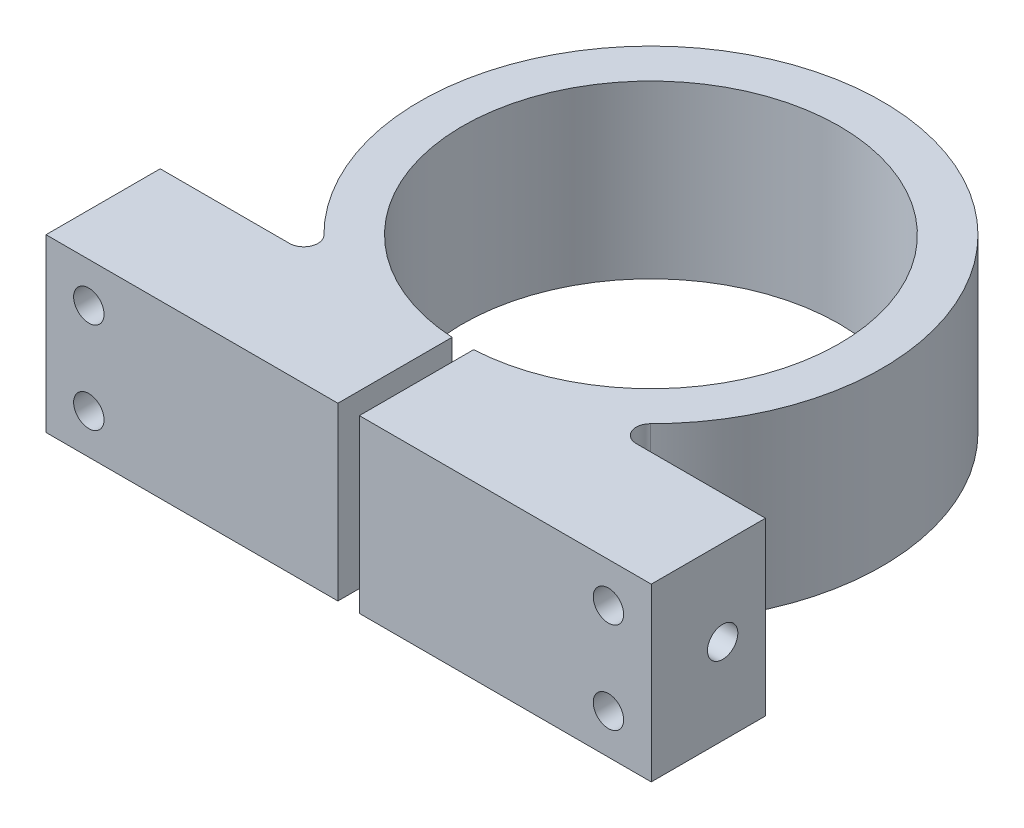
SolidWorks part; units mm, degrees
ref_plane "Front Plane" through (0, 0, 0) normal (0, 0, 1) x (1, 0, 0)
ref_plane "Top Plane" through (0, 0, 0) normal (0, 1, 0) x (1, 0, 0)
ref_plane "Right Plane" through (0, 0, 0) normal (1, 0, 0) x (0, 0, -1)
sketch "Sketch1" plane through (0, 0, 0) normal (0, 1, 0) x (1, 0, 0)
  line L0 (2.3876, -67.2419) -> (67.31, -67.2419)
  line L1 (-67.31, -41.8419) -> (-38.5632, -41.8419)
  line L2 (-67.31, -41.8419) -> (-67.31, -67.2419)
  line L3 (-67.31, -67.2419) -> (-2.3876, -67.2419)
  line L4 (67.31, -41.8419) -> (67.31, -67.2419)
  line L5 (38.5632, -41.8419) -> (67.31, -41.8419)
  line L6 (-51.435, 0) -> (51.435, 0) construction
  line L8 (-2.3876, -67.2419) -> (-2.3876, -41.8419)
  line L10 (2.3876, -67.2419) -> (2.3876, -41.8419)
  arc A0 (2.3876, -41.8419) -> (-2.3876, -41.8419) centre (0, 0) ccw
  arc A1 (36.3212, -36.4189) -> (-36.3212, -36.4189) centre (0, 0) ccw
  arc A2 (-38.5632, -41.8419) -> (-36.3212, -36.4189) centre (-38.5632, -38.6669) ccw
  arc A3 (36.3212, -36.4189) -> (38.5632, -41.8419) centre (38.5632, -38.6669) ccw
  dimension "D3" = 9.525
  dimension "D4" = 41.91
  dimension "D8" = 3.175
  dimension "D1" = 15.875
  dimension "D5" = 25.4
  dimension "D6" = 4.7752
  dimension "D7" = 2.3876
  dimension "D9" = 15.875
extrude "Extrude1" add sketch "Sketch1" along normal blind 38.1
hole_wizard "1/4 Clearance Hole2" positions "3DSketch1" profile "Sketch2" hole size "1/4" standard "Ansi Inch"
sketch3d "3DSketch1"
  line L0 (-67.31, 0, 41.8419) -> (-67.31, 0, 67.2419) construction
  line L2 (-67.31, 38.1, 67.2419) -> (-67.31, 0, 67.2419) construction
  point P0 (-67.31, 19.05, 51.3669)
  dimension "D1" = 19.05
  dimension "D2" = 15.875
sketch "Sketch2" plane through (-67.31, 19.05, 51.3669) normal (0, 1, 0) x (0, 0, 1)
  line L0 (0, 0) -> (0, 134.62)
  line L1 (0, 134.62) -> (3.3782, 134.62)
  line L2 (3.3782, 134.62) -> (3.3782, 0)
  line L5 (3.3782, 0) -> (0, 0)
  line L11 (0, -6.35) -> (0, 107.95) construction
  dimension "Thru Hole Dia." = 6.7564
  dimension "Thru Hole Depth" = 134.62
hole_wizard "1/4 Clearance Hole1" positions "3DSketch2" profile "Sketch3" hole size "1/4" standard "Ansi Inch"
sketch3d "3DSketch2"
  line L0 (-67.31, 38.1, 41.8419) -> (-67.31, 0, 41.8419) construction
  line L1 (-38.5632, 38.1, 41.8419) -> (-67.31, 38.1, 41.8419) construction
  point P0 (-57.785, 29.21, 41.8419)
  dimension "D1" = 9.525
  dimension "D2" = 8.89
sketch "Sketch3" plane through (-57.785, 29.21, 41.8419) normal (1, 0, 0) x (0, 1, 0)
  line L0 (0, 0) -> (0, 25.4)
  line L1 (0, 25.4) -> (3.3782, 25.4)
  line L2 (3.3782, 25.4) -> (3.3782, 0)
  line L5 (3.3782, 0) -> (0, 0)
  line L11 (0, -6.35) -> (0, 107.95) construction
  dimension "Thru Hole Dia." = 6.7564
  dimension "Thru Hole Depth" = 25.4
hole_wizard "1/4 Clearance Hole3" positions "3DSketch3" profile "Sketch4" hole size "1/4" standard "Ansi Inch"
sketch3d "3DSketch3"
  line L0 (67.31, 38.1, 41.8419) -> (67.31, 0, 41.8419) construction
  line L1 (67.31, 38.1, 41.8419) -> (38.5632, 38.1, 41.8419) construction
  point P0 (57.785, 29.21, 41.8419)
  dimension "D1" = 9.525
  dimension "D2" = 8.89
sketch "Sketch4" plane through (57.785, 29.21, 41.8419) normal (1, 0, 0) x (0, 1, 0)
  line L0 (0, 0) -> (0, 25.4)
  line L1 (0, 25.4) -> (3.3782, 25.4)
  line L2 (3.3782, 25.4) -> (3.3782, 0)
  line L5 (3.3782, 0) -> (0, 0)
  line L11 (0, -6.35) -> (0, 107.95) construction
  dimension "Thru Hole Dia." = 6.7564
  dimension "Thru Hole Depth" = 25.4
pattern_linear "LPattern1" count 2 spacing 20.32 along (0, -1, 0) of "1/4 Clearance Hole3", "1/4 Clearance Hole1"
